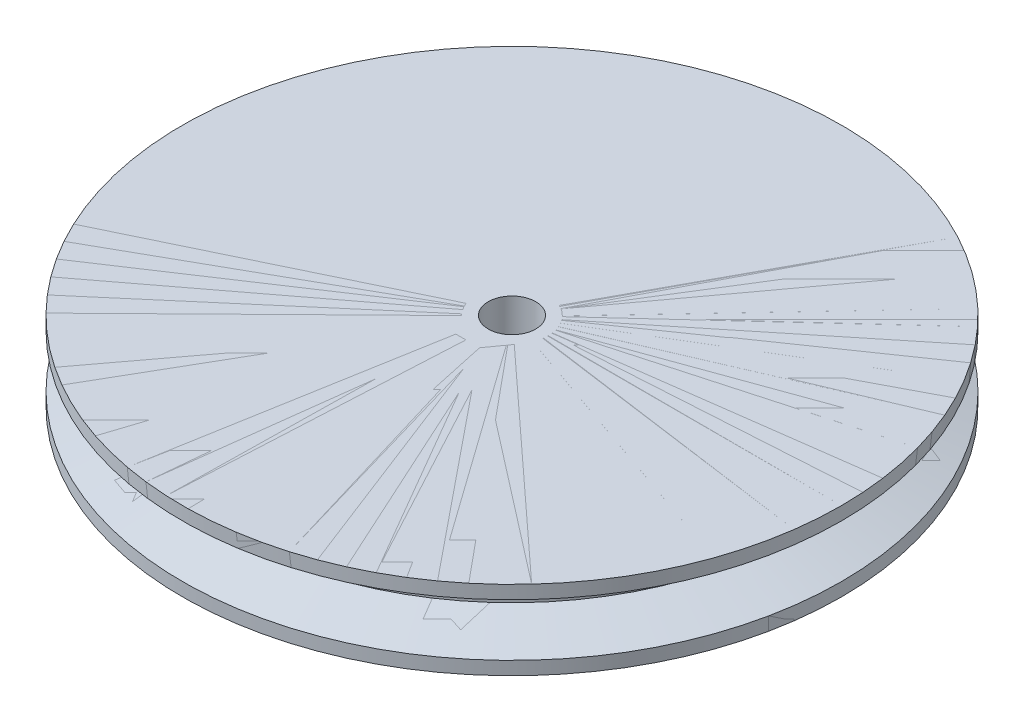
SolidWorks part; units mm, degrees
ref_plane "Front" through (0, 0, 0) normal (0, 0, 1) x (1, 0, 0)
ref_plane "Top" through (0, 0, 0) normal (0, 1, 0) x (1, 0, 0)
ref_plane "Right" through (0, 0, 0) normal (1, 0, 0) x (0, 0, -1)
imported_body "Imported1"
sketch "Esquisse1" plane through (0, -40, 0) normal (0, -1, 0) x (1, 0, 0)
  line L0 (-3, 8.4853) -> (-3, 11.2)
  line L1 (-3, 11.2) -> (3, 11.2)
  line L2 (3, 11.2) -> (3, 8.4853)
  arc A0 (-3, 8.4853) -> (3, 8.4853) centre (0, 0) ccw
  dimension "D1" = 18
  dimension "D2" = 6
  dimension "D3" = 3
  dimension "D4" = 11.2
extrude "Enlèv. mat.-Extru.1" cut sketch "Esquisse1" against normal through all
sketch "Esquisse2" plane through (0, 0, 11.2) normal (0, 0, -1) x (-1, 0, 0)
  line L0 (-30, -40) -> (30, -40) construction
  circle A0 centre (0, -33) radius 3
  dimension "D1" = 6
  dimension "D2" = 7
extrude "Enlèv. mat.-Extru.2" cut sketch "Esquisse2" against normal through all
